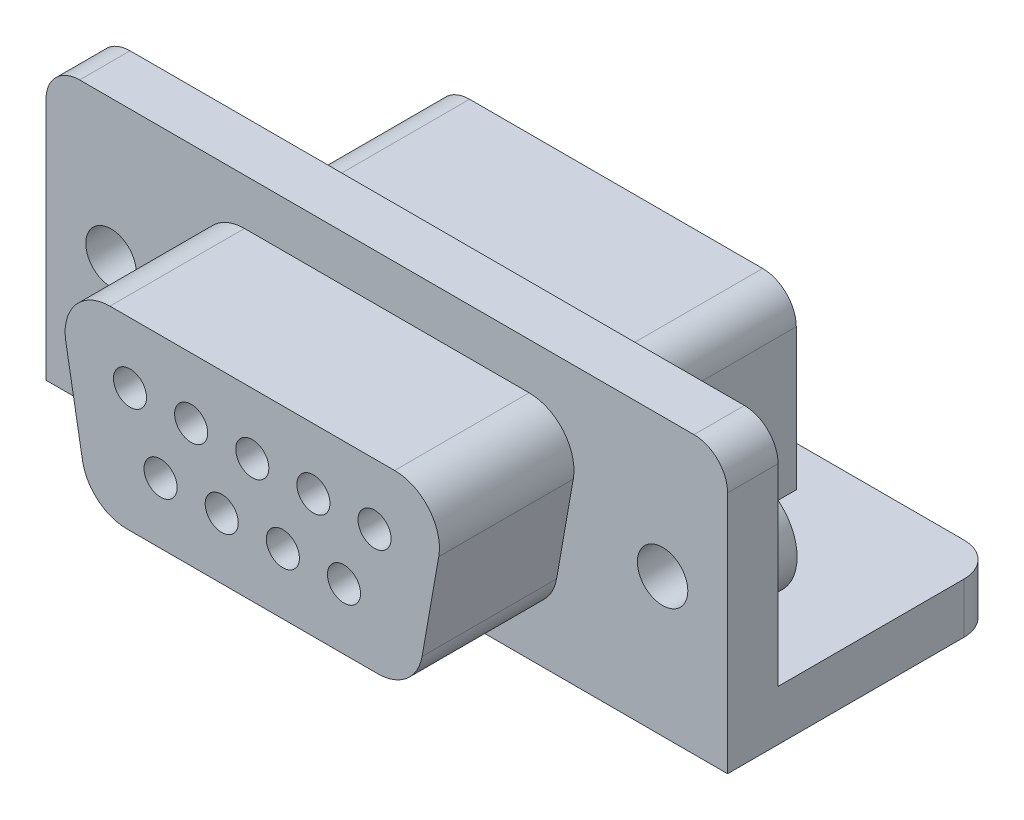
SolidWorks part; units mm, degrees
ref_plane "Plane1" through (0, 0, 0) normal (0, 0, 1) x (1, 0, 0)
ref_plane "Plane2" through (0, 0, 0) normal (0, 1, 0) x (1, 0, 0)
ref_plane "Plane3" through (0, 0, 0) normal (1, 0, 0) x (0, 0, -1)
sketch "Sketch1" plane through (0, 0, 0) normal (0, 0, 1) x (1, 0, 0)
  line L0 (0, 0) -> (30.8864, 0)
  line L1 (0, 0) -> (0, 12.5476)
  line L2 (30.8864, 12.5476) -> (0, 12.5476)
  line L3 (30.8864, 12.5476) -> (30.8864, 0)
  dimension "D1" = 30.8864
  dimension "D2" = 12.5476
extrude "Base-Extrude" add sketch "Sketch1" along normal blind 2.286
sketch "Sketch2"
  line L0 (9.7518, 2.0938) -> (21.1346, 2.0938)
  line L1 (23.1357, 3.7729) -> (23.8932, 8.0689)
  line L2 (21.8921, 10.4538) -> (8.9943, 10.4538)
  line L3 (6.9932, 8.0689) -> (7.7507, 3.7729)
  line L4 (15.4432, 0) -> (15.4432, 2.0938) construction
  line L5 (0, 0) -> (30.8864, 0) construction
  line L7 (0, 6.2738) -> (15.4432, 6.2738) construction
  line L8 (0, 0) -> (0, 12.5476) construction
  line L9 (15.4432, 2.0938) -> (15.4432, 10.4538) construction
  arc A0 (6.9932, 8.0689) -> (8.9943, 10.4538) centre (8.9943, 8.4218) cw
  arc A1 (23.8932, 8.0689) -> (21.8921, 10.4538) centre (21.8921, 8.4218) ccw
  arc A2 (7.7507, 3.7729) -> (9.7518, 2.0938) centre (9.7518, 4.1258) ccw
  arc A3 (23.1357, 3.7729) -> (21.1346, 2.0938) centre (21.1346, 4.1258) cw
  dimension "D5" = 2.032
  dimension "D2" = 80
  dimension "D3" = 8.36
  dimension "D4" = 80
  dimension "D7" = 16.9
fillet "Fillet1" radius 1.524 2 edges at (30.8864, 12.5476, 1.143) (0, 12.5476, 1.143)
extrude "Boss-Extrude1" add sketch "Sketch2" along normal blind 6.096
sketch "Sketch3" plane through (0, 0, 2.286) normal (0, 0, 1) x (1, 0, 0)
  line L0 (0, 0) -> (30.8864, 0) construction
  circle A0 centre (27.94, 6.2738) radius 1.143
  circle A1 centre (2.9464, 6.2738) radius 1.143
  point P8 (15.4432, 0)
  dimension "D1" = 24.9936
  dimension "D2" = 6.2738
  dimension "D3" = 2.286
  dimension "D4" = 12.4968
extrude "Cut-Extrude1" cut sketch "Sketch3" against normal through all
sketch "Sketch4" plane through (0, 0, 0) normal (0, 0, -1) x (-1, 0, 0)
  line L0 (0, 0) -> (-30.8864, 0) construction
  line L1 (0, 0) -> (-30.8864, 0)
  line L2 (0, 0) -> (0, 11.0236) construction
  line L3 (0, 0) -> (0, 2.286)
  line L4 (-30.8864, 11.0236) -> (-30.8864, 0) construction
  line L5 (-30.8864, 2.286) -> (-30.8864, 0)
  line L6 (-30.8864, 2.286) -> (0, 2.286)
  dimension "D1" = 2.286
extrude "Boss-Extrude2" add sketch "Sketch4" along normal blind 9.9568
fillet "Fillet2" radius 1.524 4 edges at (0, 1.143, -9.9568) (30.8864, 1.143, -9.9568)
sketch "Sketch5" plane through (0, 0, 0) normal (0, 0, -1) x (-1, 0, 0)
  circle A0 centre (-2.9464, 6.2738) radius 2.286
  circle A1 centre (-27.94, 6.2738) radius 2.286
  dimension "D1" = 4.572
extrude "Boss-Extrude3" add sketch "Sketch5" along normal blind 1.524
sketch "Sketch6" plane through (0, 0, -1.524) normal (0, 0, -1) x (-1, 0, 0)
  circle A0 centre (-27.94, 6.2738) radius 1.143 construction
  circle A1 centre (-2.9464, 6.2738) radius 1.143 construction
  circle A2 centre (-27.94, 6.2738) radius 1.143
  circle A3 centre (-2.9464, 6.2738) radius 1.143
extrude "Cut-Extrude2" cut sketch "Sketch6" against normal through all
sketch "Sketch7" plane through (0, 0, 0) normal (0, 0, -1) x (-1, 0, 0)
  line L1 (-22.0599, 10.2108) -> (-8.7802, 10.2108)
  line L2 (-7.2562, 8.6868) -> (-7.2562, 2.286)
  line L3 (-29.3624, 2.286) -> (-1.524, 2.286) construction
  line L4 (-23.5839, 8.6868) -> (-23.5839, 2.286)
  line L5 (-23.5839, 2.286) -> (-7.2562, 2.286)
  arc A2 (-7.2562, 8.6868) -> (-8.7802, 10.2108) centre (-8.7802, 8.6868) ccw
  arc A3 (-22.0599, 10.2108) -> (-23.5839, 8.6868) centre (-22.0599, 8.6868) ccw
extrude "Boss-Extrude4" add sketch "Sketch7" along normal blind 8.128
sketch "Sketch8" plane through (0, 0, 8.382) normal (0, 0, 1) x (1, 0, 0)
  line L0 (15.4432, 10.4538) -> (15.4432, 2.0938) construction
  line L1 (21.8921, 10.4538) -> (8.9943, 10.4538) construction
  line L2 (9.7518, 2.0938) -> (21.1346, 2.0938) construction
  line L3 (15.4432, 6.2738) -> (8.5146, 6.2738) construction
  line L4 (9.9032, 7.6938) -> (15.4432, 7.6938) construction
  line L5 (11.2882, 4.8538) -> (15.4432, 4.8538) construction
  circle A0 centre (9.9032, 7.6938) radius 0.75
  circle A1 centre (20.9832, 7.6938) radius 0.75
  circle A2 centre (18.2132, 7.6938) radius 0.75
  circle A3 centre (11.2882, 4.8538) radius 0.75
  circle A4 centre (12.6732, 7.6938) radius 0.75
  circle A5 centre (14.0582, 4.8538) radius 0.75
  circle A6 centre (15.4432, 7.6938) radius 0.75
  circle A7 centre (16.8282, 4.8538) radius 0.75
  circle A8 centre (19.5982, 4.8538) radius 0.75
  dimension "D1" = 1.42
  dimension "D2" = 2.84
  dimension "D3" = 1.5
  dimension "D4" = 2.77
  dimension "D5" = 2.77
  dimension "D6" = 2.77
  dimension "D7" = 1.385
extrude "Cut-Extrude3" cut sketch "Sketch8" against normal blind 6.35
sketch "Sketch9" plane through (0, 0, 0) normal (0, -1, 0) x (1, 0, 0)
  line L0 (0, 2.286) -> (30.8864, 2.286) construction
  circle A0 centre (2.9464, -7.239) radius 1.397
  circle A1 centre (27.94, -7.239) radius 1.397
  point P6 (15.4432, 2.286)
  dimension "D1" = 2.794
  dimension "D3" = 24.9936
  dimension "D2" = 9.525
  dimension "D4" = 12.4968
